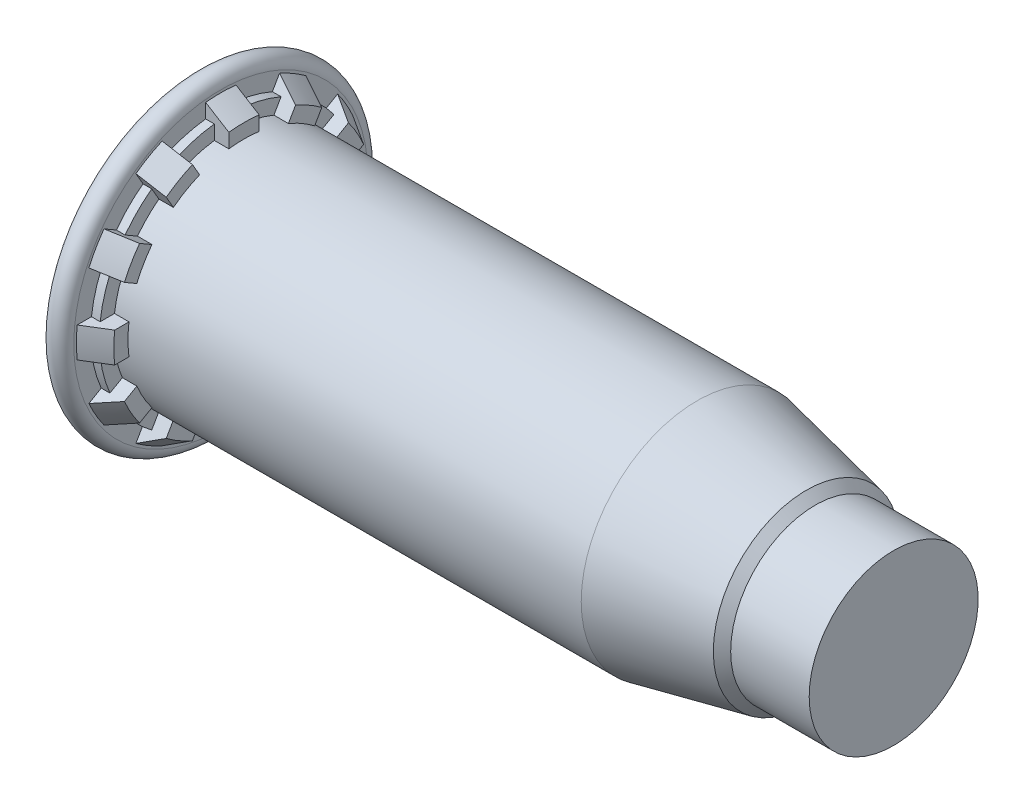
SolidWorks part; units mm, degrees
ref_plane "Plane1" through (0, 0, 0) normal (0, 0, 1) x (1, 0, 0)
ref_plane "Plane2" through (0, 0, 0) normal (0, 1, 0) x (1, 0, 0)
ref_plane "Plane3" through (0, 0, 0) normal (1, 0, 0) x (0, 0, -1)
sketch "BodySke" plane through (0, 0, 0) normal (0, 0, 1) x (1, 0, 0)
  line L0 (0, 0) -> (0, 3.7975)
  line L1 (0.6, 3.8025) -> (0.6, 3.735)
  line L2 (0.6, 3.735) -> (1.2, 3.3675)
  line L3 (1.2, 3) -> (12.92, 3)
  line L5 (18, 0) -> (0, 0)
  line L6 (0, 0) -> (50.554, 0) construction
  line L7 (1.2, 3.3675) -> (1.2, 3)
  line L8 (15.7455, 2.4095) -> (12.92, 3)
  line L9 (-9.525, 4.1) -> (9.525, 4.1) construction
  line L11 (2.2, 19.05) -> (2.2, -3.175) construction
  line L12 (18, 2.185) -> (18, 0)
  line L13 (9.525, -4.1) -> (-9.525, -4.1) construction
  line L14 (0.0051, 3.8025) -> (0.0051, 3.7975)
  line L15 (0, 3.7975) -> (0.0051, 3.7975)
  line L16 (15.97, 2.185) -> (18, 2.185)
  line L17 (15.7455, 2.4095) -> (15.97, 2.185)
  arc A0 (0.0051, 3.8025) -> (0.6, 3.8025) centre (0.3025, 3.8025) cw
  dimension "D2" = 0.0051
  dimension "D1" = 0.0051
  dimension "Diameter" = 6
  dimension "D5" = 45
  dimension "Length" = 18
  dimension "Minor_dia" = 4.819
  dimension "Advance" = 1
  dimension "H_dia" = 8.2
  dimension "Shoulder_lower_dia" = 7.47
  dimension "Shoulder_upper_dia" = 6.735
  dimension "Shoulder_ht" = 1.2
  dimension "T_dim" = 0.6
  dimension "Dog_dia" = 4.37
  dimension "Dog_len" = 2.03
  dimension "Thread_trans" = 3.05
revolve "BaseBody" add sketch "BodySke" angle 360 about L6
sketch "ThdSchSke" plane through (0, 0, 0) normal (0, 0, 1) x (1, 0, 0)
  line L0 (3, -2.4095) -> (2.5865, -3)
  line L1 (3, -2.4095) -> (3.4135, -3)
  line L2 (3.4135, -3) -> (3.4135, -3.75)
  line L3 (-3.175, 0) -> (5.1513, 0) construction
  line L5 (3.4135, -3.75) -> (2.5865, -3.75)
  line L6 (2.5865, -3.75) -> (2.5865, -3)
  line L7 (0, 3.7975) -> (0, -3.7975) construction
  dimension "Thread_minor" = 4.819
  dimension "Diameter" = 6
  dimension "Start" = 3
  dimension "SideAngle" = 55
  dimension "VeeAngle" = 70
  dimension "Overcut" = 7.5
revolve "ThreadSchematic" [suppressed] cut sketch "ThdSchSke" angle 360 about L3
pattern_linear "ThdSchPat" [suppressed]
sketch "RibCut1Ske" plane through (1.2, 0, 0) normal (1, 0, 0) x (0, 0, -1)
  line L0 (0.3916, 2.9743) -> (0.3916, 4.0813)
  line L1 (1.1481, 2.7716) -> (1.7015, 3.7303)
  line L2 (0, 0) -> (0, 4.9784) construction
  line L3 (0, 0) -> (0.3916, 2.9743) construction
  line L4 (0, 0) -> (1.1481, 2.7716) construction
  arc A1 (1.1481, 2.7716) -> (0.3916, 2.9743) centre (0, 0) ccw
  arc A2 (1.7015, 3.7303) -> (0.3916, 4.0813) centre (0, 0) ccw
  dimension "Inner_dia" = 6
  dimension "Outer_dia" = 8.2
  dimension "Rib_root_half_angle" = 7.5
  dimension "Rib_root_gap_angle" = 15
  dimension "Angle" = 30
extrude "RibCut1" cut sketch "RibCut1Ske" against normal blind 0.375
sketch "RibCut2Ske" plane through (1.2, 0, 0) normal (1, 0, 0) x (0, 0, -1)
  line L0 (0.3916, 3.3447) -> (0.3916, 4.0813)
  line L1 (1.3332, 3.0923) -> (1.7015, 3.7303)
  line L2 (0.3916, 2.9743) -> (0.3916, 4.7861) construction
  line L3 (0, 0) -> (0, 5.0239) construction
  line L4 (0, 0) -> (0.3916, 2.9743) construction
  line L5 (0, 0) -> (1.1481, 2.7716) construction
  line L6 (1.1481, 2.7716) -> (2.0575, 4.3468) construction
  arc A1 (1.3332, 3.0923) -> (0.3916, 3.3447) centre (0, 0) ccw
  arc A2 (1.7015, 3.7303) -> (0.3916, 4.0813) centre (0, 0) ccw
  circle A4 centre (0, 0) radius 3 construction
  dimension "Inner_dia" = 6.735
  dimension "Outer_dia" = 8.2
  dimension "Rib_root_dia" = 6
  dimension "Rib_root_half_angle" = 7.5
  dimension "Rib_root_gap_angle" = 15
  dimension "Angle" = 30
extrude "RibCut2" cut sketch "RibCut2Ske" against normal blind 0.6
pattern_circular "RibCutsPat" count 12 every 30 about axis through (0, 0, 0) along (1, 0, 0) of "RibCut2", "RibCut1"
equation "' \"Length@BodySke\" = 18"
equation "' \"H_dia@BodySke\" = 8.2"
equation "' \"Start@ThdSchSke\" = 3"
equation "' \"Dog_dia@BodySke\" = 4.37"
equation "' \"Dog_len@BodySke\" = 2.03"
equation "' \"Thread_trans@BodySke\" = 3.05"
equation "' \"Diameter@BodySke\" = 6"
equation "' \"Minor_dia@BodySke\" = 4.819"
equation "' \"Advance@BodySke\" = 1"
equation "\"T_dim@BodySke\" = \"Start@ThdSchSke\" * 0.2"
equation "\"Shoulder_ht@BodySke\" = \"Start@ThdSchSke\" * 0.4"
equation "\"Shoulder_lower_dia@BodySke\" = \"H_dia@BodySke\" - \"Start@ThdSchSke\" * 0.2 - .13"
equation "\"Shoulder_upper_dia@BodySke\" = ( \"Shoulder_lower_dia@BodySke\" + \"Diameter@BodySke\" ) /2"
equation "\"Num_ribs@RibCutsPat\" = 12"
equation "\"Angle@RibCutsPat\" = 360 / \"Num_ribs@RibCutsPat\""
equation "\"Angle@RibCut1Ske\" =\"Angle@RibCutsPat\""
equation "\"Rib_root_half_angle@RibCut1Ske\" = \"Angle@RibCut1Ske\" / 4"
equation "\"Rib_root_gap_angle@RibCut1Ske\" = \"Angle@RibCut1Ske\" - (2 * \"Rib_root_half_angle@RibCut1Ske\" )"
equation "\"Inner_dia@RibCut1Ske\" = \"Diameter@BodySke\""
equation "\"Outer_dia@RibCut1Ske\" = \"H_dia@BodySke\""
equation "\"Depth@RibCut1\" =  \"Start@ThdSchSke\" * 0.125"
equation "\"Angle@RibCut2Ske\" =\"Angle@RibCutsPat\""
equation "\"Rib_root_half_angle@RibCut2Ske\" = \"Angle@RibCut1Ske\" / 4"
equation "\"Rib_root_gap_angle@RibCut2Ske\" = \"Angle@RibCut1Ske\" - (2 * \"Rib_root_half_angle@RibCut1Ske\" )"
equation "\"Rib_root_dia@RibCut2Ske\" = \"Diameter@BodySke\""
equation "\"Inner_dia@RibCut2Ske\" = \"Shoulder_upper_dia@BodySke\""
equation "\"Outer_dia@RibCut2Ske\" = \"H_dia@BodySke\""
equation "\"Depth@RibCut2\" =  \"Start@ThdSchSke\" * 0.2"
equation "\"Thread_length@ThreadCosmetic\" = \"Length@BodySke\" - \"Start@ThdSchSke\"  - \"Dog_len@BodySke\"  - ( \"Minor_dia@BodySke\" - \"Dog_dia@BodySke\" ) / 2"
equation "\"Thread_minor@ThreadCosmetic\" = \"Minor_dia@BodySke\""
equation "\"Thread_minor@ThdSchSke\" = \"Minor_dia@BodySke\""
equation "\"Diameter@ThdSchSke\" = \"Diameter@BodySke\""
equation "\"Overcut@ThdSchSke\" = \"Diameter@BodySke\" * 1.25"
equation "\"Num_threads@ThdSchPat\" = int( \"Thread_length@ThreadCosmetic\" / \"Advance@BodySke\" + 0.999 )  + 1"
equation "\"Advance@ThdSchPat\" = \"Thread_length@ThreadCosmetic\" /  (\"Num_threads@ThdSchPat\" - 1) 'relax it"
equation "\"Num_threads@ThdSchPat\" = \"Num_threads@ThdSchPat\" - sgn( \"Num_threads@ThdSchPat\" - 1) '---chamfered tips only---"
